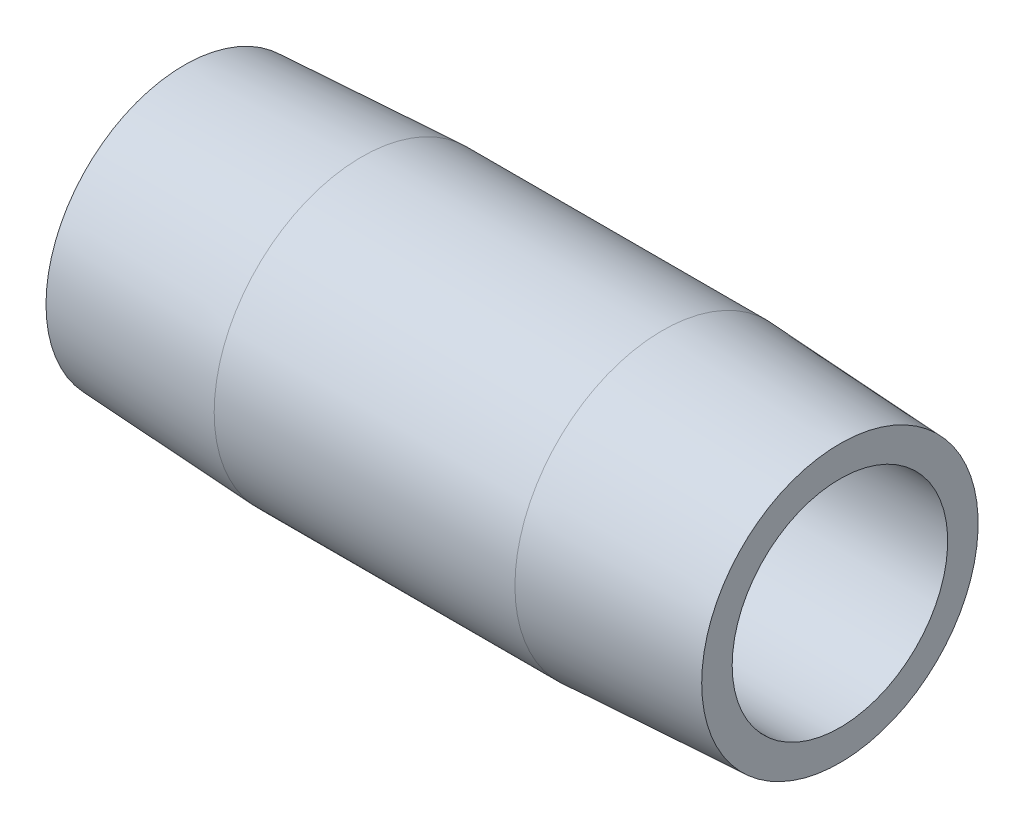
SolidWorks part; units mm, degrees
ref_plane "Front Plane" through (0, 0, 0) normal (0, 0, 1) x (1, 0, 0)
ref_plane "Top Plane" through (0, 0, 0) normal (0, 1, 0) x (1, 0, 0)
ref_plane "Right Plane" through (0, 0, 0) normal (1, 0, 0) x (0, 0, -1)
sketch "Sketch1" plane through (0, 0, 0) normal (0, 0, 1) x (1, 0, 0)
  line L5 (38.1, 6.2611) -> (0, 6.2611)
  line L6 (27.7876, 8.5725) -> (10.3124, 8.5725)
  line L7 (10.3124, 8.5725) -> (0, 8.0321)
  line L8 (38.1, 8.0321) -> (27.7876, 8.5725)
  line L9 (38.1, 6.2611) -> (38.1, 8.0321)
  line L10 (0, 6.2611) -> (0, 8.0321)
  line L11 (0, 0) -> (50000, 0) construction
  line L12 (0, -55) -> (0, 55) construction
  dimension "D1" = 12.5222
  dimension "D2" = 17.145
  dimension "D3" = 3
  dimension "D4" = 3
  dimension "D5" = 38.1
  dimension "D6" = 10.3124
  dimension "D7" = 10.3124
revolve "Revolve1" add sketch "Sketch1" angle 360 about L11
